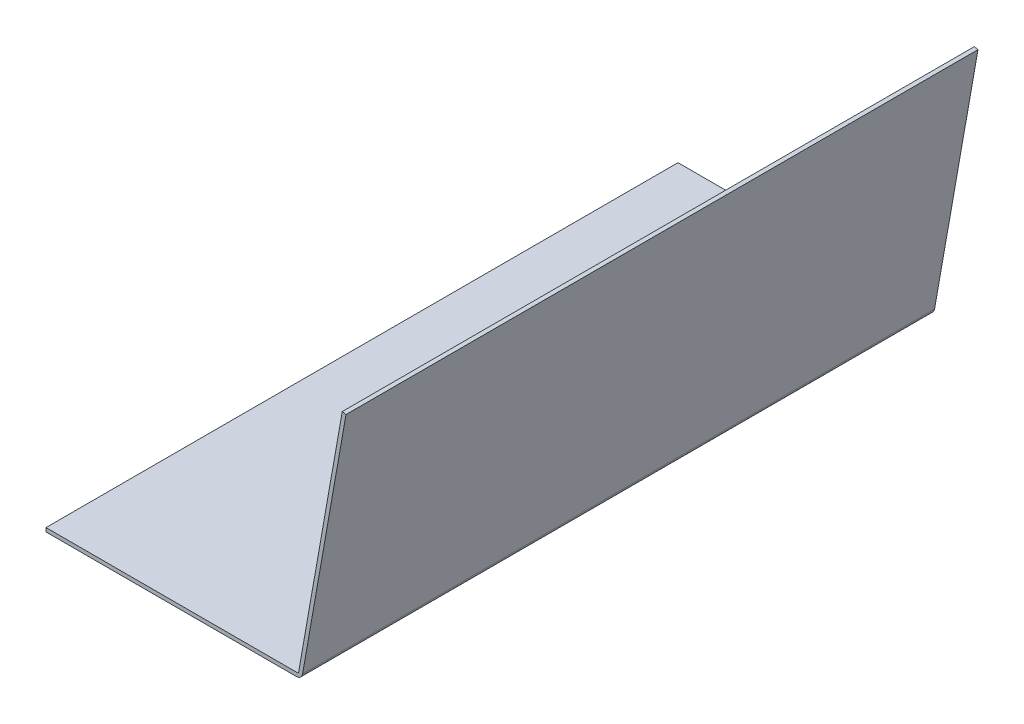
SolidWorks part; units mm, degrees
ref_plane "Plan de face" through (0, 0, 0) normal (0, 0, 1) x (1, 0, 0)
ref_plane "Plan de dessus" through (0, 0, 0) normal (0, 1, 0) x (1, 0, 0)
ref_plane "Plan de droite" through (0, 0, 0) normal (1, 0, 0) x (0, 0, -1)
sketch "Esquisse2" plane through (0, 0, 0) normal (0, 0, 1) x (1, 0, 0)
  line L0 (-66.4028, 0) -> (132.0972, 0)
  line L1 (132.0972, 0) -> (166.5663, 195.4843)
  dimension "D1" = 198.5
  dimension "D2" = 198.5
extrude "Extru.-Mince1" add sketch "Esquisse2" along normal blind 497 thin
fillet "Congé2" radius 5 1 edges at (134.6145, -3, 248.5)
